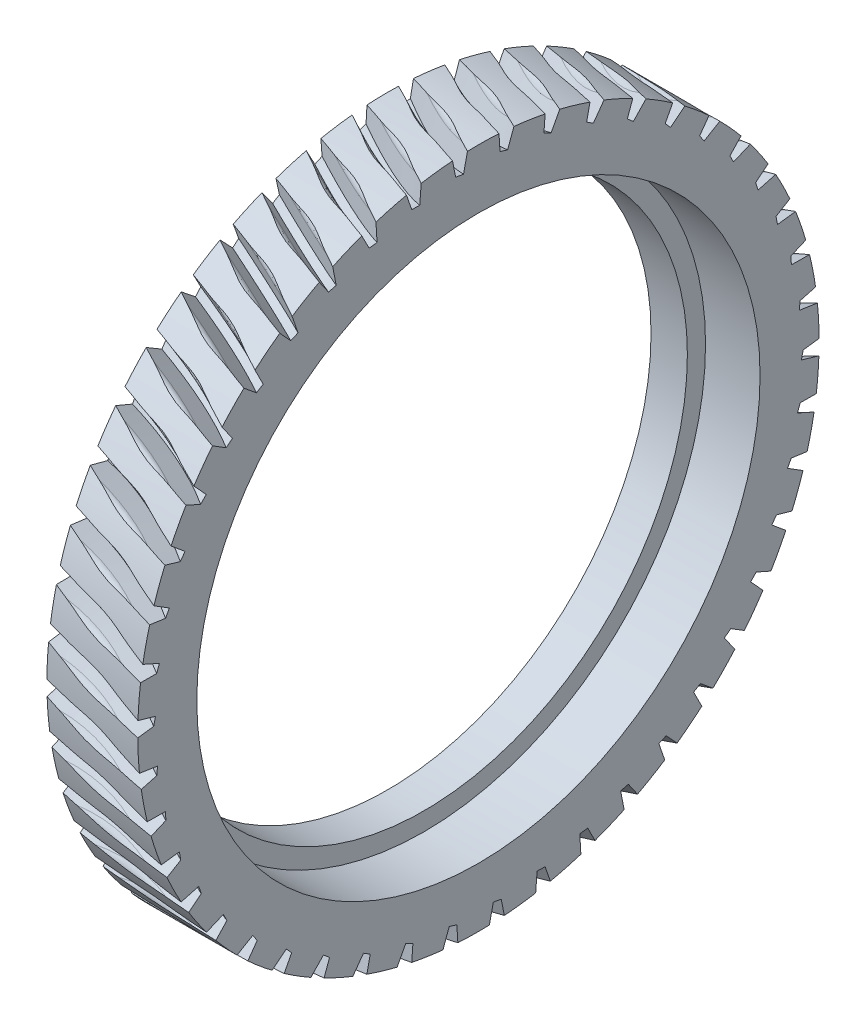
SolidWorks part; units mm, degrees
ref_plane "Plane1" through (0, 0, 0) normal (0, 0, 1) x (1, 0, 0)
ref_plane "Plane2" through (0, 0, 0) normal (0, 1, 0) x (1, 0, 0)
ref_plane "Plane3" through (0, 0, 0) normal (1, 0, 0) x (0, 0, -1)
sketch "Esquisse1" plane through (0, 0, 0) normal (0, 0, 1) x (1, 0, 0)
  line L0 (0, 31) -> (0, 37.5)
  line L1 (0, 37.5) -> (-10, 37.5)
  line L2 (-10, 37.5) -> (-10, 29)
  line L3 (-10, 29) -> (-6, 29)
  line L4 (-6, 29) -> (-6, 31)
  line L5 (-6, 31) -> (0, 31)
  line L6 (0, 0) -> (17, 0) construction
  line L7 (-5, 0) -> (-5, 50) construction
  dimension "D1" = 37.5
  dimension "D2" = 31
  dimension "D3" = 29
  dimension "D4" = 6
  dimension "D5" = 10
  dimension "D6" = 5
revolve "Base-Révolution" add sketch "Esquisse1" angle 360 about L6
sketch "Esquisse2" plane through (0, 0, 0) normal (0, 0, 1) x (1, 0, 0)
  line L0 (-5, 0) -> (-5, 20) construction
  dimension "D1" = 5
ref_plane "Plan6" through (-0.7322, 0, 1.7678) normal (0.3827, 0, -0.9239) x (-0.9239, 0, -0.3827)
ref_plane "Plan7" through (-4.2678, 0, -1.7678) normal (-0.9239, 0, -0.3827) x (-0.3827, 0, 0.9239)
sketch "Esquisse4" plane through (-4.2678, 0, -1.7678) normal (-0.9239, 0, -0.3827) x (-0.3827, 0, 0.9239)
  line L0 (-13.9, 48.5) -> (25.1, 48.5) construction
  line L1 (1.0016, 36.9079) -> (1.5134, 34.5)
  line L2 (1.5134, 34.5) -> (2.3134, 34.5)
  line L3 (1.9134, 0) -> (1.9134, 16.5056) construction
  line L4 (1.9134, 19.1595) -> (1.9134, -19.1595) construction
  line L5 (2.8252, 36.9079) -> (2.3134, 34.5)
  line L6 (-3.9, 37.7) -> (-3.9, 39.7)
  line L7 (-3.9, 37.7) -> (0.0235, 37.7)
  line L8 (8.1, 37.7) -> (3.8034, 37.7)
  line L9 (-3.9, 39.7) -> (8.1, 39.7)
  line L10 (8.1, 39.7) -> (8.1, 37.7)
  line L11 (1.9134, 34.5) -> (1.9134, 44.8852) construction
  arc A0 (1.0016, 36.9079) -> (0.0235, 37.7) centre (0.0235, 36.7) ccw
  arc A1 (3.8034, 37.7) -> (2.8252, 36.9079) centre (3.8034, 36.7) ccw
  dimension "D1" = 0.8
  dimension "D3" = 34.5
  dimension "D5" = 3.2
  dimension "D6" = 2
  dimension "D7" = 14
  dimension "D8" = 12
  dimension "D9" = 12
revolve "Enlever de la matière-Révolution1" cut sketch "Esquisse4" angle 360 about L0
pattern_circular "Répétition circulaire1" count 46 every 7.826 about axis through (0, 0, 0) along (1, 0, 0)
